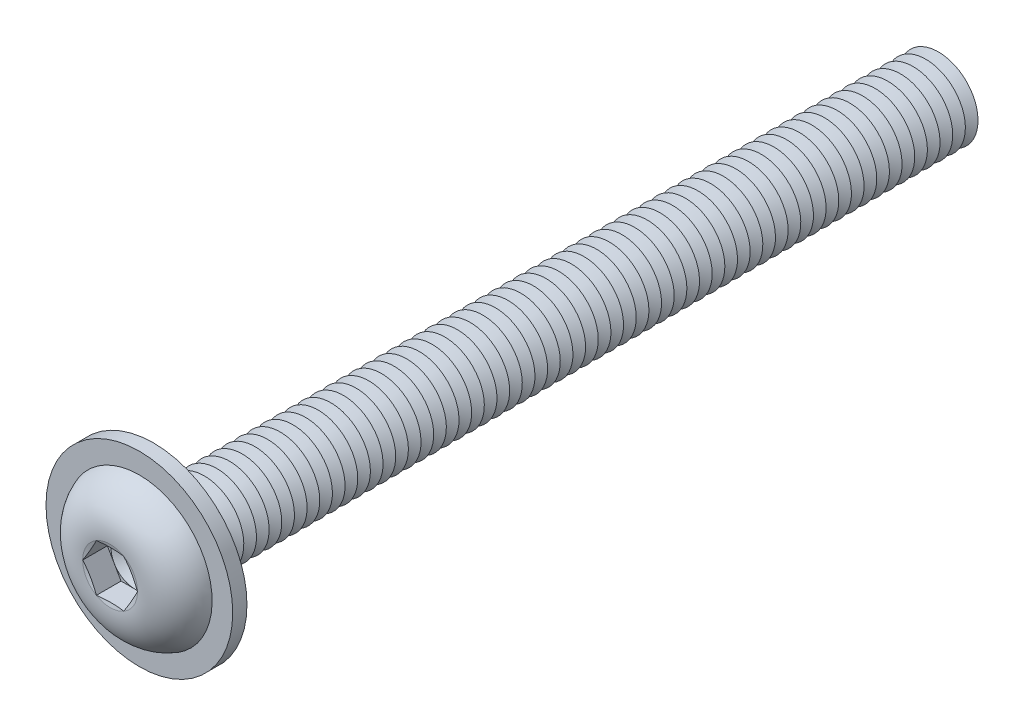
SolidWorks part; units mm, degrees
ref_plane "Front Plane" through (0, 0, 0) normal (0, 0, 1) x (1, 0, 0)
ref_plane "Top Plane" through (0, 0, 0) normal (0, 1, 0) x (1, 0, 0)
ref_plane "Right Plane" through (0, 0, 0) normal (1, 0, 0) x (0, 0, -1)
sketch "Sketch1" plane through (0, 0, 0) normal (1, 0, 0) x (0, 0, -1)
  line L0 (0, 2.5) -> (0, 4.75)
  line L3 (0, 2.5) -> (50, 2.5)
  line L4 (50, 2.5) -> (50, 0)
  line L5 (50, 0) -> (-2.75, 0) construction
  line L6 (-2.75, 0) -> (50, 0)
  line L7 (-2.75, 1.732) -> (-2.75, 0.866) construction
  line L8 (-2.75, 0.866) -> (-2.75, 0)
  line L9 (-2.75, 1.732) -> (-2.5179, 0.866)
  line L10 (-2.5179, 0.866) -> (-2.75, 0.866)
  line L11 (50, 0) -> (22.7481, 0) construction
  line L12 (0, 4.75) -> (-2.75, 4.75) construction
  arc A1 (0, 4.75) -> (-2.75, 1.732) centre (0, 1.9881) ccw
  point P8 (50, 1.25)
  dimension "D1" = 9.5
  dimension "D2" = 5
  dimension "D3" = 2.75
  dimension "D4" = 3.4641
  dimension "D5" = 50
  dimension "D6" = 15
revolve "Revolve1" add sketch "Sketch1" angle 360 about L5
fillet "Fillet1" radius 0.4 1 edges at (0, 2.5, 0)
sketch "Sketch2" plane through (0, 0, 0) normal (1, 0, 0) x (0, 0, -1)
  line L0 (49.6, 2.5) -> (50.4, 2.5)
  line L1 (50, 2.5) -> (0.4, 2.5) construction
  line L2 (50.4, 2.5) -> (50, 1.8072)
  line L3 (50, -2.5) -> (50, 2.5) construction
  line L4 (50, 1.8072) -> (49.6, 2.5)
  dimension "D1" = 0.8
revolve "Cut-Revolve1" cut sketch "Sketch2" angle 360 about axis through (0, 0, -50) along (0, 0, -1)
pattern_linear "LPattern1" count 62 spacing 0.8 along (0, 0, 1) of "Cut-Revolve1"
sketch "Sketch3" plane through (0, 0, 2.75) normal (0, 0, 1) x (1, 0, 0)
  line L7 (0.866, 1.5) -> (-0.866, 1.5)
  line L8 (-0.866, 1.5) -> (-1.7321, 0)
  line L9 (-1.7321, 0) -> (-0.866, -1.5)
  line L10 (-0.866, -1.5) -> (0.866, -1.5)
  line L11 (0.866, -1.5) -> (1.732, 0)
  line L12 (1.732, 0) -> (0.866, 1.5)
  circle A0 centre (0, 0) radius 1.5 construction
  circle A3 centre (0, 0) radius 1.7321 construction
extrude "Cut-Extrude1" cut sketch "Sketch3" against normal blind 1.56
sketch "Sketch4" plane through (0, 0, 1.19) normal (0, 0, 1) x (1, 0, 0)
  line L1 (0.866, 1.5) -> (-0.866, 1.5) construction
  circle A0 centre (0, 0) radius 1.5
extrude "Cut-Extrude2" cut sketch "Sketch4" against normal through all draft 60
sketch "Sketch5" plane through (0, 0, 0) normal (0, 0, -1) x (-1, 0, 0)
  circle A0 centre (0, 0) radius 5.9
  circle A1 centre (0, 0) radius 2.9
  circle A2 centre (0, 0) radius 2.9 construction
  dimension "D1" = 11.8
extrude "Boss-Extrude1" add sketch "Sketch5" against normal blind 0.9
